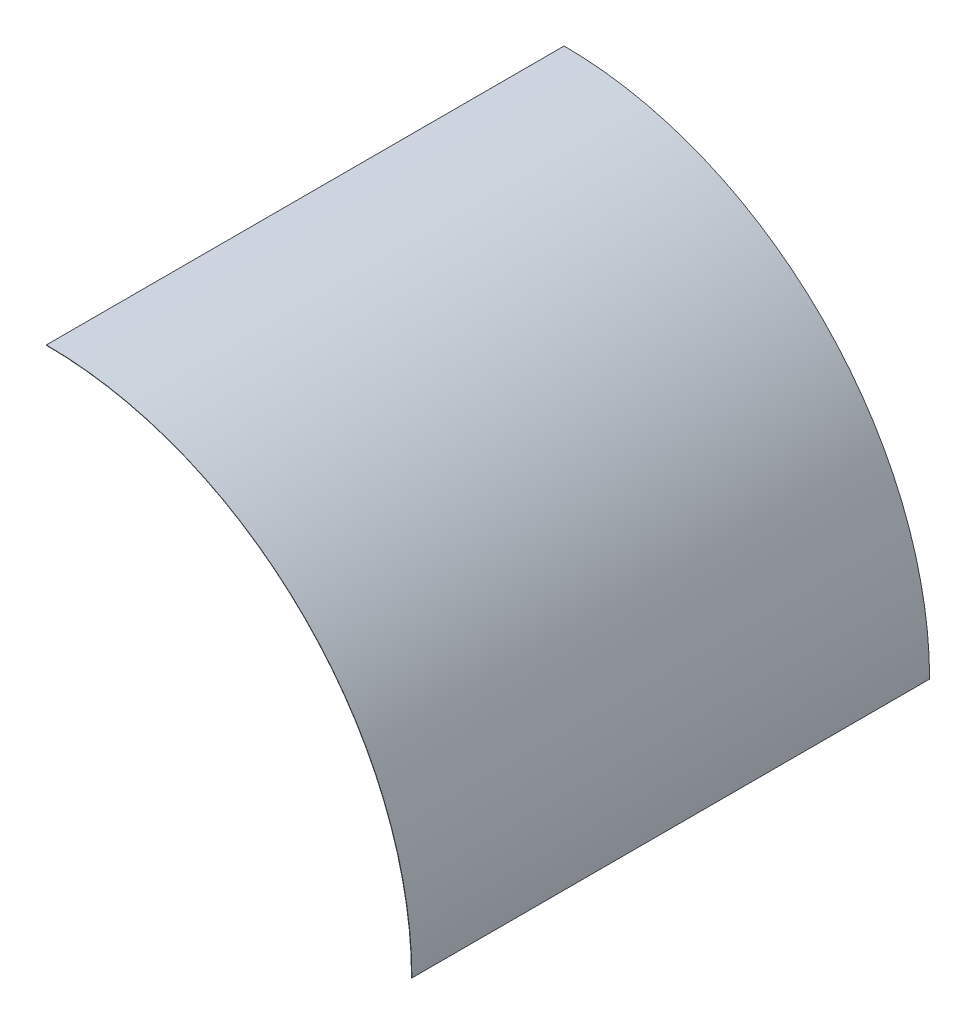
SolidWorks part; units mm, degrees
ref_plane "Front Plane" through (0, 0, 0) normal (0, 0, 1) x (1, 0, 0)
ref_plane "Top Plane" through (0, 0, 0) normal (0, 1, 0) x (1, 0, 0)
ref_plane "Right Plane" through (0, 0, 0) normal (1, 0, 0) x (0, 0, -1)
sketch "Sketch1" plane through (0, 0, 0) normal (0, 0, 1) x (1, 0, 0)
  line L0 (0, 0) -> (0, 45.174) construction
  line L1 (0, 0) -> (40.8023, 0) construction
  line L2 (0, 2118) -> (0, 2116)
  line L3 (2118, 0) -> (2116, 0)
  arc A0 (0, 2116) -> (2116, 0) centre (0, 0) cw
  arc A1 (0, 2118) -> (2118, 0) centre (0, 0) cw
  dimension "D1" = 2116
  dimension "D2" = 2
extrude "Boss-Extrude1" add sketch "Sketch1" against normal blind 3000
